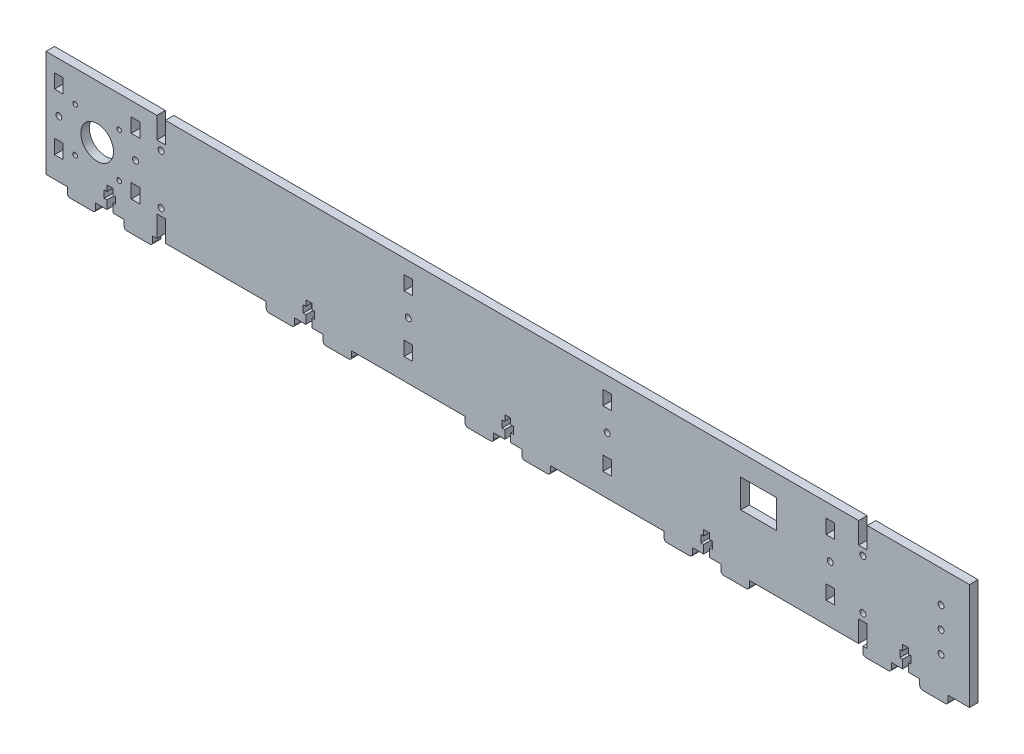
SolidWorks part; units mm, degrees
ref_plane "Спереди" through (0, 0, 0) normal (0, 0, 1) x (1, 0, 0)
ref_plane "Сверху" through (0, 0, 0) normal (0, 1, 0) x (1, 0, 0)
ref_plane "Справа" through (0, 0, 0) normal (1, 0, 0) x (0, 0, -1)
sketch "Эскиз1" plane through (0, 0, 0) normal (0, 0, 1) x (1, 0, 0)
  line L0 (325, 75) -> (325, 128.9644) construction
  line L1 (0, 0) -> (650, 0)
  line L2 (0, 0) -> (0, 75)
  line L3 (0, 75) -> (650, 75)
  line L4 (650, 0) -> (650, 75)
  line L5 (635, 0) -> (635, -4)
  line L6 (15, 0) -> (35, 0)
  line L7 (15, 0) -> (15, -4)
  line L8 (17, -6) -> (33, -6)
  line L9 (35, 0) -> (35, -4)
  line L10 (55, 0) -> (75, 0)
  line L11 (55, 0) -> (55, -4)
  line L12 (57, -6) -> (73, -6)
  line L13 (75, 0) -> (75, -4)
  line L14 (155, 0) -> (175, 0)
  line L15 (155, 0) -> (155, -4)
  line L16 (157, -6) -> (173, -6)
  line L17 (175, 0) -> (175, -4)
  line L18 (195, 0) -> (215, 0)
  line L19 (195, 0) -> (195, -4)
  line L20 (197, -6) -> (213, -6)
  line L21 (215, 0) -> (215, -4)
  line L22 (295, 0) -> (315, 0)
  line L23 (295, 0) -> (295, -4)
  line L24 (297, -6) -> (313, -6)
  line L25 (315, 0) -> (315, -4)
  line L26 (42.9, 0) -> (47.1, 0)
  line L27 (42.9, 0) -> (42.9, 15)
  line L28 (42.9, 15) -> (47.1, 15)
  line L29 (47.1, 0) -> (47.1, 15)
  line L30 (41, 11) -> (49, 11)
  line L31 (41, 11) -> (41, 5.9)
  line L32 (41, 5.9) -> (49, 5.9)
  line L33 (49, 11) -> (49, 5.9)
  line L34 (182.9, 0) -> (187.1, 0)
  line L35 (182.9, 0) -> (182.9, 15)
  line L36 (182.9, 15) -> (187.1, 15)
  line L37 (187.1, 0) -> (187.1, 15)
  line L38 (181, 11) -> (189, 11)
  line L39 (181, 11) -> (181, 5.9)
  line L40 (181, 5.9) -> (189, 5.9)
  line L41 (189, 11) -> (189, 5.9)
  line L42 (322.9, 0) -> (327.1, 0)
  line L43 (322.9, 0) -> (322.9, 15)
  line L44 (322.9, 15) -> (327.1, 15)
  line L45 (327.1, 0) -> (327.1, 15)
  line L46 (321, 11) -> (329, 11)
  line L47 (321, 11) -> (321, 5.9)
  line L48 (321, 5.9) -> (329, 5.9)
  line L49 (329, 11) -> (329, 5.9)
  line L50 (461, 11) -> (461, 5.9)
  line L51 (469, 5.9) -> (461, 5.9)
  line L52 (469, 11) -> (469, 5.9)
  line L53 (469, 11) -> (461, 11)
  line L54 (462.9, 0) -> (462.9, 15)
  line L55 (467.1, 15) -> (462.9, 15)
  line L56 (467.1, 0) -> (467.1, 15)
  line L57 (467.1, 0) -> (462.9, 0)
  line L58 (601, 11) -> (601, 5.9)
  line L59 (609, 5.9) -> (601, 5.9)
  line L60 (609, 11) -> (609, 5.9)
  line L61 (609, 11) -> (601, 11)
  line L62 (602.9, 0) -> (602.9, 15)
  line L63 (607.1, 15) -> (602.9, 15)
  line L64 (607.1, 0) -> (607.1, 15)
  line L65 (607.1, 0) -> (602.9, 0)
  line L66 (335, 0) -> (335, -4)
  line L67 (353, -6) -> (337, -6)
  line L68 (355, 0) -> (355, -4)
  line L69 (355, 0) -> (335, 0)
  line L70 (435, 0) -> (435, -4)
  line L71 (453, -6) -> (437, -6)
  line L72 (455, 0) -> (455, -4)
  line L73 (455, 0) -> (435, 0)
  line L74 (475, 0) -> (475, -4)
  line L75 (493, -6) -> (477, -6)
  line L76 (495, 0) -> (495, -4)
  line L77 (495, 0) -> (475, 0)
  line L78 (575, 0) -> (575, -4)
  line L79 (593, -6) -> (577, -6)
  line L80 (595, 0) -> (595, -4)
  line L81 (595, 0) -> (575, 0)
  line L82 (615, 0) -> (615, -4)
  line L83 (633, -6) -> (617, -6)
  line L85 (15, 58.5) -> (57, 58.5) construction
  line L86 (15, 58.5) -> (15, 16.5) construction
  line L87 (15, 16.5) -> (57, 16.5) construction
  line L88 (57, 58.5) -> (57, 16.5) construction
  line L89 (20.5, 53) -> (51.5, 53) construction
  line L90 (20.5, 53) -> (20.5, 22) construction
  line L91 (20.5, 22) -> (51.5, 22) construction
  line L92 (51.5, 53) -> (51.5, 22) construction
  arc A0 (313, -6) -> (315, -4) centre (313, -4) ccw
  arc A1 (295, -4) -> (297, -6) centre (297, -4) ccw
  arc A2 (213, -6) -> (215, -4) centre (213, -4) ccw
  arc A3 (195, -4) -> (197, -6) centre (197, -4) ccw
  arc A4 (173, -6) -> (175, -4) centre (173, -4) ccw
  arc A5 (155, -4) -> (157, -6) centre (157, -4) ccw
  arc A6 (73, -6) -> (75, -4) centre (73, -4) ccw
  arc A7 (55, -4) -> (57, -6) centre (57, -4) ccw
  arc A8 (33, -6) -> (35, -4) centre (33, -4) ccw
  arc A9 (15, -4) -> (17, -6) centre (17, -4) ccw
  arc A10 (635, -4) -> (633, -6) centre (633, -4) cw
  arc A11 (617, -6) -> (615, -4) centre (617, -4) cw
  arc A12 (595, -4) -> (593, -6) centre (593, -4) cw
  arc A13 (577, -6) -> (575, -4) centre (577, -4) cw
  arc A14 (495, -4) -> (493, -6) centre (493, -4) cw
  arc A15 (477, -6) -> (475, -4) centre (477, -4) cw
  arc A16 (455, -4) -> (453, -6) centre (453, -4) cw
  arc A17 (437, -6) -> (435, -4) centre (437, -4) cw
  arc A18 (355, -4) -> (353, -6) centre (353, -4) cw
  arc A19 (337, -6) -> (335, -4) centre (337, -4) cw
  circle A20 centre (20.5, 53) radius 1.6
  circle A21 centre (51.5, 53) radius 1.6
  circle A22 centre (51.5, 22) radius 1.6
  circle A23 centre (20.5, 22) radius 1.6
  circle A24 centre (36, 37.5) radius 11.5
  circle A25 centre (630, 52.5) radius 2.1
  circle A26 centre (630, 37.5) radius 2.1
  circle A27 centre (630, 22.5) radius 2.1
  point P51 (45, 15)
  point P52 (45, 11)
  point P53 (325, 11)
  point P54 (325, 15)
  point P55 (185, 15)
  point P56 (185, 11)
  point P59 (315, -6)
  point P62 (295, -6)
  point P65 (215, -6)
  point P68 (195, -6)
  point P71 (175, -6)
  point P74 (155, -6)
  point P77 (75, -6)
  point P80 (55, -6)
  point P83 (35, -6)
  point P86 (15, -6)
  point P91 (635, -6)
  point P144 (615, -6)
  point P145 (595, -6)
  point P146 (575, -6)
  point P147 (495, -6)
  point P148 (475, -6)
  point P149 (455, -6)
  point P150 (435, -6)
  point P151 (355, -6)
  point P152 (335, -6)
  point P153 (465, 11)
  point P154 (465, 15)
  point P155 (605, 11)
  point P156 (605, 15)
  point P165 (36, 53)
  point P166 (36, 58.5)
  point P167 (20.5, 37.5)
  point P168 (15, 37.5)
  point P175 (0, 37.5)
  point P182 (650, 37.5)
extrude "Бобышка-Вытянуть1" add sketch "Эскиз1" along normal blind 6 contours L7 A9 L8 A8 L9 L1 | L11 A7 L12 A6 L13 L1 | L15 A5 L16 A4 L17 L1 | L19 A3 L20 A2 L21 L1 | L23 A1 L24 A0 L25 L1 | A19 L67 A18 L68 L1 L66 | A17 L71 A16 L72 L1 L70 | A15 L75 A14 L76 L1 L74 | A13 L79 A12 L80 L1 L78 | A11 L83 A10 L5 L1 L82 | L64 L1 L4 L3 L2 L27 L32 L31 L30 L28 L29 L33 L35 L40 L39 L38 L36 L37 L41 L43 L48 L47 L46 L44 L45 L49
sketch "Эскиз2" plane through (0, 0, 6) normal (0, 0, 1) x (1, 0, 0)
  line L0 (0, 0) -> (0, 75) construction
  line L1 (60, 65) -> (66, 65)
  line L2 (60, 65) -> (60, 55)
  line L3 (60, 55) -> (66, 55)
  line L4 (66, 65) -> (66, 55)
  line L5 (60, 25) -> (66, 25)
  line L6 (60, 25) -> (60, 15)
  line L7 (60, 15) -> (66, 15)
  line L8 (66, 25) -> (66, 15)
  line L9 (6, 65) -> (12, 65)
  line L10 (6, 65) -> (6, 55)
  line L11 (6, 55) -> (12, 55)
  line L12 (12, 65) -> (12, 55)
  line L13 (6, 25) -> (12, 25)
  line L14 (6, 25) -> (6, 15)
  line L15 (6, 15) -> (12, 15)
  line L16 (12, 25) -> (12, 15)
  line L17 (0, 75) -> (650, 75) construction
  line L18 (607.1, 15) -> (602.9, 15) construction
  line L19 (252, 65) -> (258, 65)
  line L20 (252, 65) -> (252, 55)
  line L21 (252, 55) -> (258, 55)
  line L22 (258, 65) -> (258, 55)
  line L23 (252, 25) -> (258, 25)
  line L24 (252, 25) -> (252, 15)
  line L25 (252, 15) -> (258, 15)
  line L26 (258, 25) -> (258, 15)
  line L27 (392, 65) -> (398, 65)
  line L28 (392, 65) -> (392, 55)
  line L29 (392, 55) -> (398, 55)
  line L30 (398, 65) -> (398, 55)
  line L31 (392, 25) -> (398, 25)
  line L32 (392, 25) -> (392, 15)
  line L33 (392, 15) -> (398, 15)
  line L34 (398, 25) -> (398, 15)
  line L35 (549, 65) -> (555, 65)
  line L36 (549, 65) -> (549, 55)
  line L37 (549, 55) -> (555, 55)
  line L38 (555, 65) -> (555, 55)
  line L39 (549, 25) -> (555, 25)
  line L40 (549, 25) -> (549, 15)
  line L41 (549, 15) -> (555, 15)
  line L42 (555, 25) -> (555, 15)
  line L43 (322.9, 15) -> (327.1, 15) construction
  line L44 (467.1, 15) -> (462.9, 15) construction
  line L45 (182.9, 15) -> (187.1, 15) construction
  circle A0 centre (9, 40) radius 2.1
  circle A1 centre (63, 40) radius 2.1
  circle A2 centre (20.5, 53) radius 1.6 construction
  circle A3 centre (51.5, 53) radius 1.6 construction
  circle A4 centre (552, 40) radius 2.1
  circle A5 centre (395, 40) radius 2.1
  circle A6 centre (255, 40) radius 2.1
  point P20 (9, 55)
  point P21 (9, 25)
  point P22 (63, 55)
  point P23 (63, 25)
  point P62 (255, 55)
  point P63 (255, 25)
  point P64 (395, 55)
  point P65 (395, 25)
  point P66 (552, 55)
  point P67 (552, 25)
  point P68 (605, 15)
  point P71 (325, 15)
  point P72 (465, 15)
  point P75 (185, 15)
extrude "Вырез-Вытянуть1" cut sketch "Эскиз2" against normal through all
sketch "Эскиз3" plane through (0, 0, 6) normal (0, 0, 1) x (1, 0, 0)
  line L0 (0, 75) -> (650, 75) construction
  line L1 (78, 75) -> (84, 75)
  line L2 (78, 75) -> (78, 60)
  line L3 (78, 60) -> (84, 60)
  line L4 (84, 75) -> (84, 60)
  line L5 (75, 0) -> (155, 0) construction
  line L6 (78, 0) -> (84, 0)
  line L7 (78, 0) -> (78, 15)
  line L8 (78, 15) -> (84, 15)
  line L9 (84, 0) -> (84, 15)
  line L10 (66, 55) -> (66, 65) construction
  line L11 (495, 0) -> (575, 0) construction
  line L12 (572, 75) -> (578, 75)
  line L13 (572, 75) -> (572, 60)
  line L14 (572, 60) -> (578, 60)
  line L15 (578, 75) -> (578, 60)
  line L16 (572, 0) -> (578, 0)
  line L17 (572, 0) -> (572, 15)
  line L18 (572, 15) -> (578, 15)
  line L19 (578, 0) -> (578, 15)
  circle A0 centre (81, 55) radius 2.1
  circle A1 centre (81, 20) radius 2.1
  circle A2 centre (575, 55) radius 2.1
  circle A3 centre (575, 20) radius 2.1
  point P14 (81, 60)
  point P15 (81, 15)
  point P18 (66, 60)
  point P35 (575, 60)
  point P36 (575, 15)
  dimension "D2" = 4.2
  dimension "D1" = 15
  dimension "D3" = 5
  dimension "D4" = 15
  dimension "D5" = 5
  dimension "D6" = 6
  dimension "D7" = 6
  dimension "D8" = 15
  dimension "D9" = 6
  dimension "D10" = 15
  dimension "D11" = 15
  dimension "D12" = 6
  dimension "D13" = 488
  dimension "D14" = 5
  dimension "D15" = 5
extrude "Вырез-Вытянуть2" cut sketch "Эскиз3" against normal through all
sketch "Эскиз4" plane through (0, 0, 6) normal (0, 0, 1) x (1, 0, 0)
  line L0 (84, 75) -> (572, 75) construction
  line L1 (489, 60) -> (514, 60)
  line L2 (489, 60) -> (489, 40)
  line L3 (489, 40) -> (514, 40)
  line L4 (514, 60) -> (514, 40)
  line L5 (549, 65) -> (549, 55) construction
  dimension "D1" = 20
  dimension "D2" = 25
  dimension "D3" = 15
  dimension "D4" = 35
extrude "Вырез-Вытянуть3" cut sketch "Эскиз4" against normal through all
equation "\"D7@Эскиз1\"=\"D6@Эскиз1\"/2"
equation "\"D29@Эскиз1\"=\"D28@Эскиз1\"/2"
equation "\"D31@Эскиз1\"=\"D30@Эскиз1\"/2"
equation "\"D15@Эскиз2\"=\"D9@Эскиз2\"/2"
equation "\"D16@Эскиз2\"=\"D10@Эскиз2\"/2"
equation "\"D32@Эскиз2\"=\"D31@Эскиз2\"/2"
equation "\"D34@Эскиз2\"=\"D33@Эскиз2\"/2"
